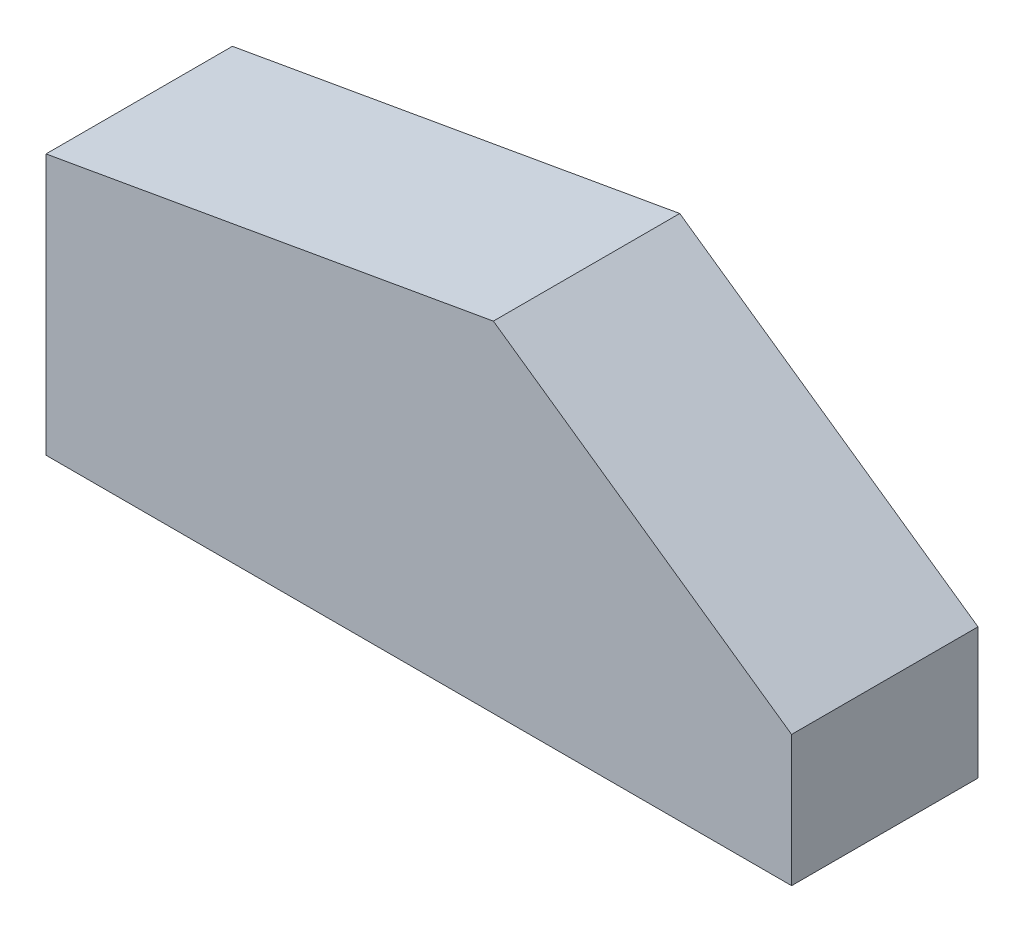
SolidWorks part; units mm, degrees
ref_plane "Front Plane" through (0, 0, 0) normal (0, 0, 1) x (1, 0, 0)
ref_plane "Top Plane" through (0, 0, 0) normal (0, 1, 0) x (1, 0, 0)
ref_plane "Right Plane" through (0, 0, 0) normal (1, 0, 0) x (0, 0, -1)
sketch "Sketch1" plane through (0, 0, 0) normal (0, 0, 1) x (1, 0, 0)
  line L0 (60, 45.5796) -> (100, 17.5713)
  line L1 (0, 0) -> (100, 0)
  line L2 (0, 0) -> (0, 35)
  line L3 (0, 35) -> (60, 45.5796)
  line L4 (100, 0) -> (100, 17.5713)
  dimension "D1" = 100
  dimension "D2" = 135
  dimension "D3" = 35
  dimension "D4" = 100
  dimension "D5" = 60
extrude "Boss-Extrude1" add sketch "Sketch1" along normal blind 25
